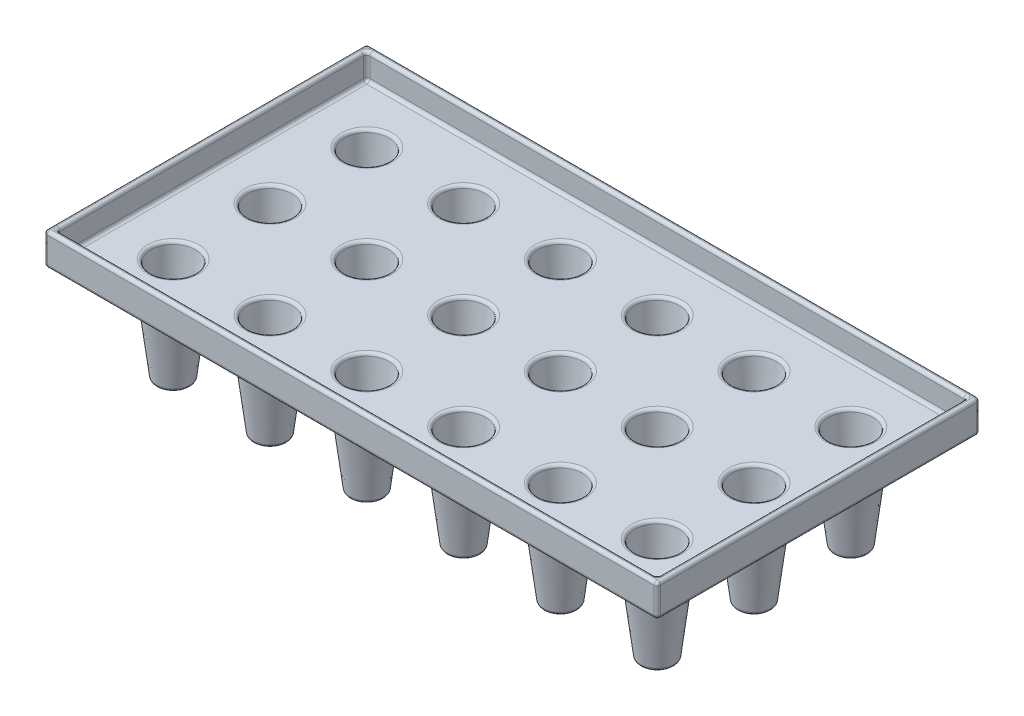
SolidWorks part; units mm, degrees
ref_plane "Front" through (0, 0, 0) normal (0, 0, 1) x (1, 0, 0)
ref_plane "Top" through (0, 0, 0) normal (0, 1, 0) x (1, 0, 0)
ref_plane "Right" through (0, 0, 0) normal (1, 0, 0) x (0, 0, -1)
sketch "Sketch1" plane through (0, 0, 0) normal (0, 1, 0) x (1, 0, 0)
  line L1 (0, 0) -> (241.3, 0)
  line L2 (0, 0) -> (0, 127)
  line L3 (0, 127) -> (241.3, 127)
  line L4 (241.3, 0) -> (241.3, 127)
  dimension "D1" = 127
  dimension "D2" = 241.3
extrude "Extrude1" add sketch "Sketch1" along normal blind 12.7
sketch "Sketch2" plane through (0, 12.7, 0) normal (0, 1, 0) x (1, 0, 0)
  line L0 (0, 0) -> (241.3, 0) construction
  line L1 (0, 127) -> (0, 0) construction
  circle A0 centre (25.4, 25.4) radius 12.7
  dimension "D1" = 25.4
  dimension "D2" = 25.4
  dimension "D3" = 25.4
extrude "Extrude2" add sketch "Sketch2" against normal blind 50.8 draft 7
pattern_linear "LPattern1" count 6 spacing 38.1 along (1, 0, 0) count 3 spacing 38.1 along (0, 0, -1) of "Extrude2"
shell "Shell1" thickness 2.54
fillet "Fillet1" radius 1.27 96 edges at (215.9, -38.1, -95.1375) (215.9, 0, -112.7406) (177.8, -38.1, -95.1375) (177.8, 0, -112.7406) (139.7, -38.1, -95.1375) (139.7, 0, -112.7406) (101.6, -38.1, -95.1375) (101.6, 0, -112.7406) (63.5, -38.1, -95.1375) (63.5, 0, -112.7406) (25.4, -38.1, -95.1375) (25.4, 0, -112.7406) (215.9, -38.1, -57.0375) (215.9, 0, -74.6406) (177.8, -38.1, -57.0375) (177.8, 0, -74.6406) (139.7, -38.1, -57.0375) (139.7, 0, -74.6406) (101.6, -38.1, -57.0375) (101.6, 0, -74.6406) (63.5, -38.1, -57.0375) (63.5, 0, -74.6406) (25.4, -38.1, -57.0375) (25.4, 0, -74.6406) (215.9, -38.1, -18.9375) (215.9, 0, -36.5406) (177.8, -38.1, -18.9375) (177.8, 0, -36.5406) (139.7, -38.1, -18.9375) (139.7, 0, -36.5406) (101.6, -38.1, -18.9375) (101.6, 0, -36.5406) (63.5, 0, -36.5406) (25.4, 0, -36.5406) (0, 6.35, 0) (241.3, 6.35, 0) (241.3, 6.35, -127) (0, 6.35, -127) (120.65, 12.7, -127) (241.3, 12.7, -63.5) (120.65, 12.7, 0) (0, 12.7, -63.5) (120.65, 0, -127) (241.3, 0, -63.5) (120.65, 0, 0) (0, 0, -63.5) (25.4, -38.1, -18.9375) (63.5, -38.1, -18.9375) (215.9, -35.56, -97.3847) (215.9, 2.54, -110.4934) (177.8, -35.56, -97.3847) (177.8, 2.54, -110.4934) (139.7, -35.56, -97.3847) (139.7, 2.54, -110.4934) (101.6, -35.56, -97.3847) (101.6, 2.54, -110.4934) (63.5, -35.56, -97.3847) (63.5, 2.54, -110.4934) (25.4, -35.56, -97.3847) (25.4, 2.54, -110.4934) (215.9, -35.56, -59.2847) (215.9, 2.54, -72.3934) (177.8, -35.56, -59.2847) (177.8, 2.54, -72.3934) (139.7, -35.56, -59.2847) (139.7, 2.54, -72.3934) (101.6, -35.56, -59.2847) (101.6, 2.54, -72.3934) (63.5, -35.56, -59.2847) (63.5, 2.54, -72.3934) (25.4, -35.56, -59.2847) (25.4, 2.54, -72.3934) (215.9, -35.56, -21.1847) (215.9, 2.54, -34.2934) (177.8, -35.56, -21.1847) (177.8, 2.54, -34.2934) (139.7, -35.56, -21.1847) (139.7, 2.54, -34.2934) (101.6, -35.56, -21.1847) (101.6, 2.54, -34.2934) (63.5, 2.54, -34.2934) (25.4, 2.54, -34.2934) (2.54, 7.62, -2.54) (238.76, 7.62, -2.54) (238.76, 7.62, -124.46) (2.54, 7.62, -124.46) (120.65, 12.7, -124.46) (238.76, 12.7, -63.5) (120.65, 12.7, -2.54) (2.54, 12.7, -63.5) (120.65, 2.54, -124.46) (238.76, 2.54, -63.5) (120.65, 2.54, -2.54) (2.54, 2.54, -63.5) (25.4, -35.56, -21.1847) (63.5, -35.56, -21.1847)
